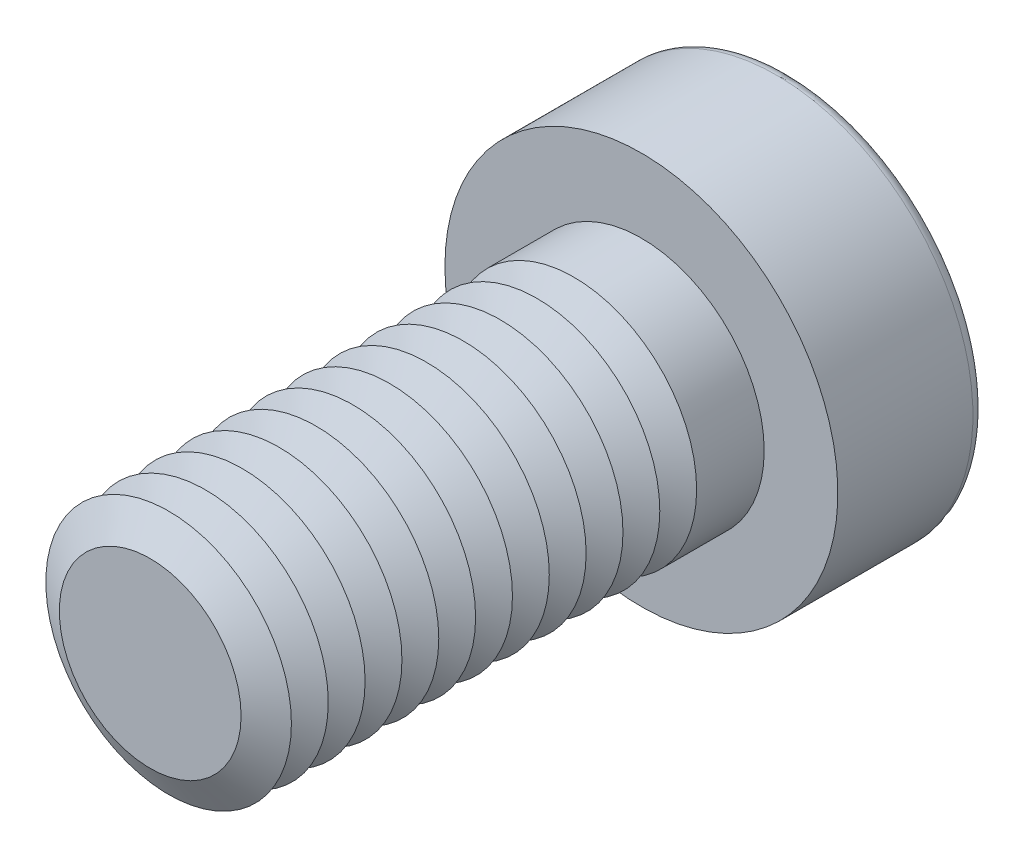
SolidWorks part; units mm, degrees
ref_plane "Front Plane" through (0, 0, 0) normal (0, 0, 1) x (1, 0, 0)
ref_plane "Top Plane" through (0, 0, 0) normal (0, 1, 0) x (1, 0, 0)
ref_plane "Right Plane" through (0, 0, 0) normal (1, 0, 0) x (0, 0, -1)
sketch "Sketch1" plane through (0, 0, 0) normal (0, 0, 1) x (1, 0, 0)
  circle A0 centre (0, 0) radius 5
  dimension "D1" = 10
extrude "Boss-Extrude1" add sketch "Sketch1" along normal blind 20
sketch "Sketch2" plane through (0, 0, 0) normal (0, 0, -1) x (-1, 0, 0)
  circle A0 centre (0, 0) radius 8
  dimension "D1" = 16
extrude "Boss-Extrude2" add sketch "Sketch2" along normal blind 6
sketch "Sketch3" plane through (0, 0, -6) normal (0, 0, -1) x (-1, 0, 0)
  line L1 (-2.0207, 3.5) -> (-4.0415, 0)
  line L2 (-4.0415, 0) -> (-2.0207, -3.5)
  line L3 (-2.0207, -3.5) -> (2.0207, -3.5)
  line L4 (2.0207, -3.5) -> (4.0415, 0)
  line L5 (4.0415, 0) -> (2.0207, 3.5)
  line L6 (2.0207, 3.5) -> (-2.0207, 3.5)
  circle A0 centre (0, 0) radius 3.5 construction
  dimension "D1" = 7
extrude "Cut-Extrude1" cut sketch "Sketch3" against normal blind 5.25
fillet "Fillet1" radius 0.5 1 edges at (-8, 0, -6)
sketch "Sketch4" plane through (0, 0, -0.75) normal (0, 0, -1) x (-1, 0, 0)
  line L0 (2.0207, -3.5) -> (4.0415, 0) construction
  circle A0 centre (0, 0) radius 3.5
extrude "Cut-Extrude2" cut sketch "Sketch4" against normal through all draft 60
sketch "Sketch5" plane through (0, 0, -6) normal (0, 0, -1) x (-1, 0, 0)
  circle A0 centre (0, 0) radius 4.0415
extrude "Cut-Extrude3" cut sketch "Sketch5" against normal through all draft 75
sketch "Sketch7" plane through (0, 0, 0) normal (1, 0, 0) x (0, 0, -1)
  line L25 (-20, 3.701) -> (-19.25, 5)
  line L26 (-20, 5) -> (-20, -5) construction
  line L27 (-19.25, 5) -> (-20.75, 5)
  line L28 (-20.75, 5) -> (-20, 3.701)
  line L29 (0, 5) -> (-20, 5) construction
  dimension "D1" = 1.5
revolve "Cut-Revolve1" cut sketch "Sketch7" angle 360 about axis through (0, 0, 20) along (0, 0, -1)
pattern_linear "LPattern1" count 12 spacing 1.5 along (0, 0, -1) of "Cut-Revolve1"
